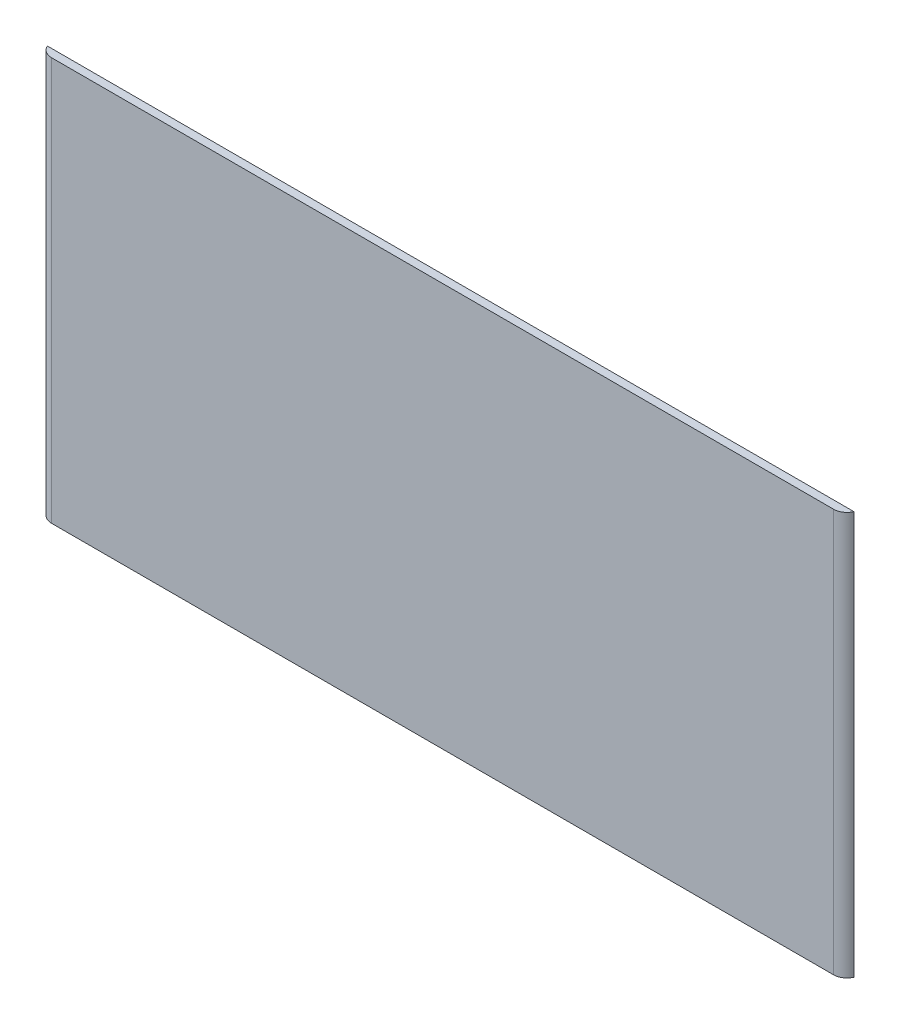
SolidWorks part; units mm, degrees
ref_plane "Plano frontal" through (0, 0, 0) normal (0, 0, 1) x (1, 0, 0)
ref_plane "Plano superior" through (0, 0, 0) normal (0, 1, 0) x (1, 0, 0)
ref_plane "Plano direito" through (0, 0, 0) normal (1, 0, 0) x (0, 0, -1)
sketch "Esboço1" plane through (0, 0, 0) normal (0, 0, 1) x (1, 0, 0)
  line L1 (0, 0) -> (600, 0)
  line L2 (0, 0) -> (0, -300)
  line L3 (0, -300) -> (600, -300)
  line L4 (600, 0) -> (600, -300)
  dimension "D1" = 600
  dimension "D2" = 300
extrude "Ressalto-extrusão2" add sketch "Esboço1" along normal blind 6
fillet "Filete1" radius 10 1 edges at (600, -150, 6)
fillet "Filete2" radius 10 1 edges at (0, -150, 6)
